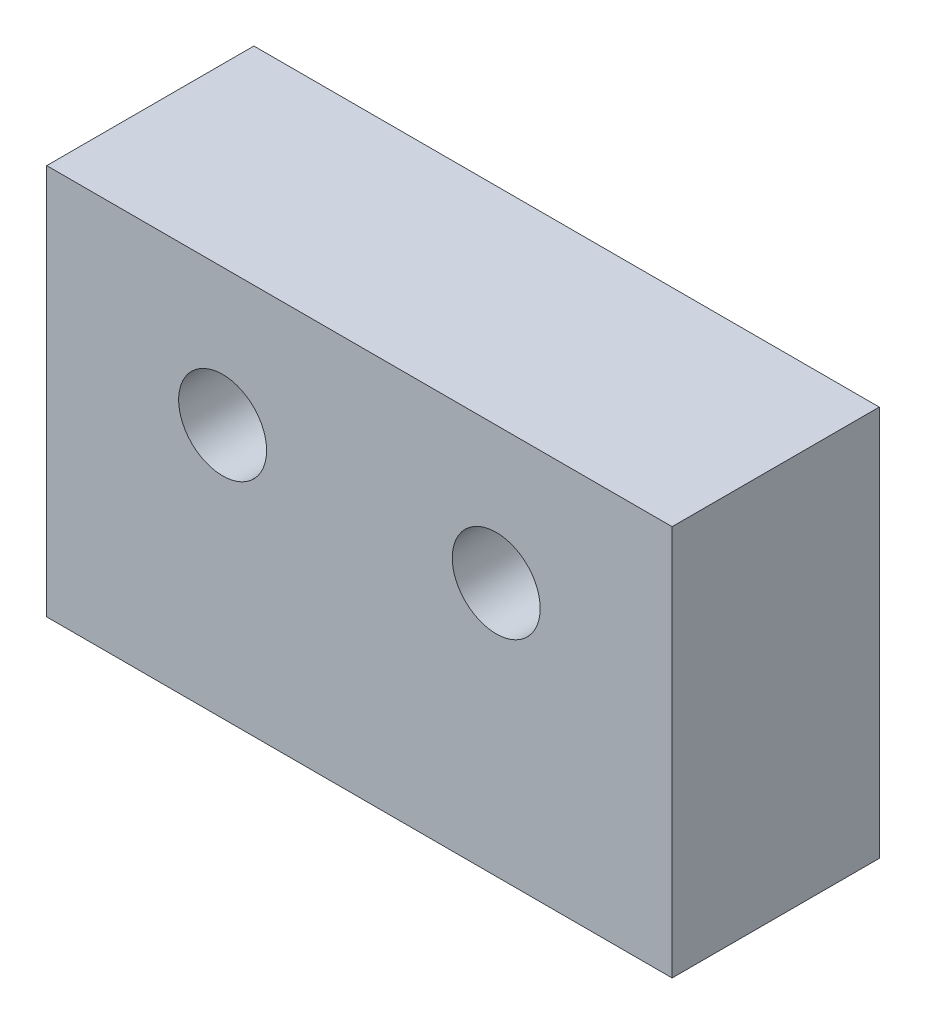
SolidWorks part; units mm, degrees
ref_plane "前视基准面" through (0, 0, 0) normal (0, 0, 1) x (1, 0, 0)
ref_plane "上视基准面" through (0, 0, 0) normal (0, 1, 0) x (1, 0, 0)
ref_plane "右视基准面" through (0, 0, 0) normal (1, 0, 0) x (0, 0, -1)
sketch "草图2" plane through (0, 0, 0) normal (0, 0, 1) x (1, 0, 0)
  line L0 (0, 0) -> (32, 0)
  line L1 (0, -20) -> (32, -20)
  line L2 (0, -20) -> (0, 0)
  line L3 (32, -20) -> (32, 0)
  circle A0 centre (9, -7) radius 2.25
  circle A1 centre (23, -7) radius 2.25
extrude "凸台-拉伸1" add sketch "草图2" along normal blind 10.6
